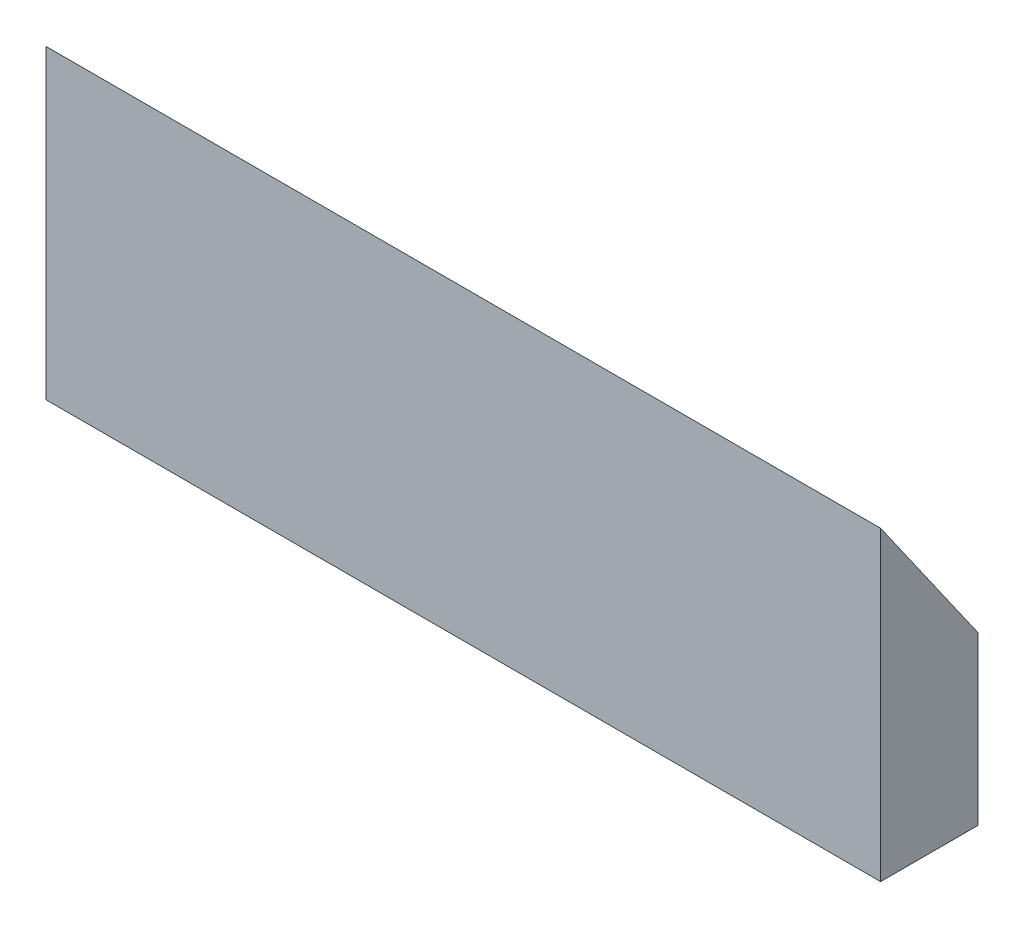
SolidWorks part; units mm, degrees
ref_plane "Front Plane" through (0, 0, 0) normal (0, 0, 1) x (1, 0, 0)
ref_plane "Top Plane" through (0, 0, 0) normal (0, 1, 0) x (1, 0, 0)
ref_plane "Right Plane" through (0, 0, 0) normal (1, 0, 0) x (0, 0, -1)
sketch "Sketch1" plane through (0, 0, 0) normal (0, 0, 1) x (1, 0, 0)
  line L0 (0, 0) -> (3, 0)
  line L1 (3, 0) -> (3, -0.6)
  line L2 (3, -0.6) -> (0, -0.6)
  line L3 (0, -0.6) -> (0, 0)
  dimension "D1" = 0.6
  dimension "D2" = 3
extrude "Boss-Extrude1" add sketch "Sketch1" along normal blind 0.35
ref_plane "Plane1" through (0, 0, 0) normal (-1, 0, 0) x (0, 0, 1)
sketch "Sketch3" plane through (0, 0, 0) normal (-1, 0, 0) x (0, 0, 1)
  line L0 (0.35, 0) -> (0.35, 0.5)
  line L1 (0.35, 0.5) -> (0, 0)
  line L2 (0, 0) -> (0.35, 0)
  dimension "D1" = 0.5
extrude "Boss-Extrude3" add sketch "Sketch3" against normal up to surface (3 mm away)
